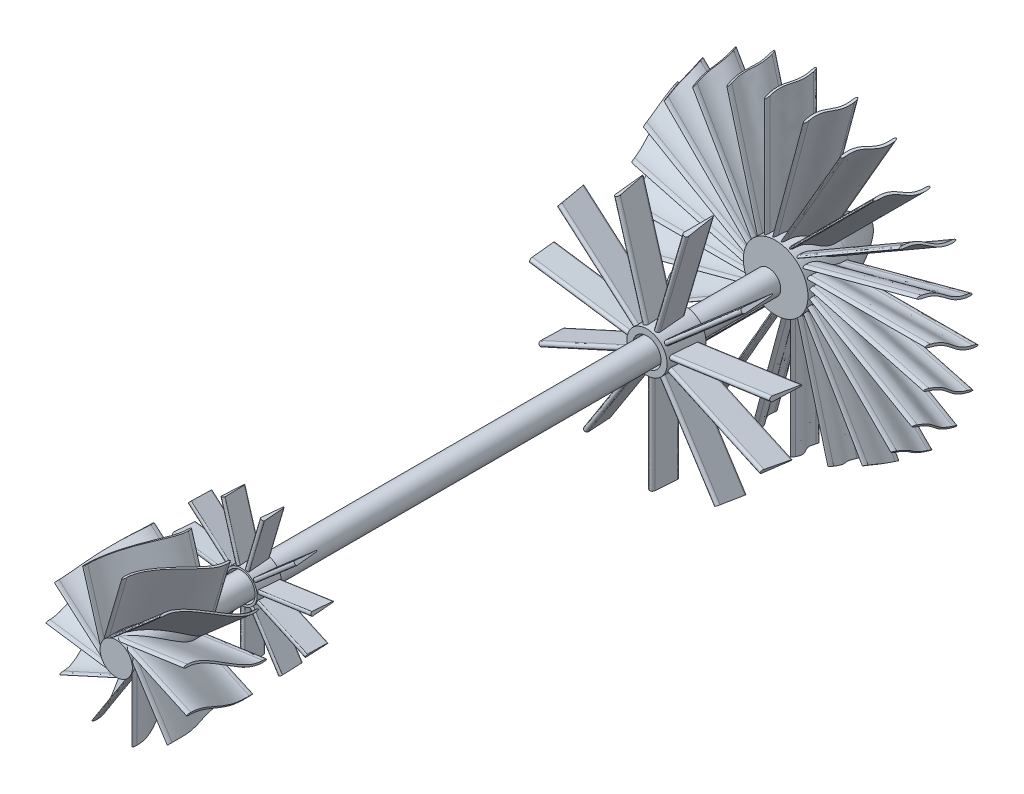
SolidWorks part; units mm, degrees
ref_plane "Front Plane" through (0, 0, 0) normal (0, 0, 1) x (1, 0, 0)
ref_plane "Top Plane" through (0, 0, 0) normal (0, 1, 0) x (1, 0, 0)
ref_plane "Right Plane" through (0, 0, 0) normal (1, 0, 0) x (0, 0, -1)
sketch "Sketch1" plane through (0, 0, 0) normal (0, 0, 1) x (1, 0, 0)
  circle A0 centre (0, 0) radius 50.8
  dimension "D1" = 101.6
extrude "Boss-Extrude1" add sketch "Sketch1" along normal blind 63.5
sketch "Sketch2" plane through (0, 0, 0) normal (1, 0, 0) x (0, 0, -1)
  line L0 (0, 0) -> (83.5751, 0) construction
  line L1 (83.5751, 12.1171) -> (83.5751, -12.1171) construction
  line L2 (12.7755, -50.8) -> (-12.7755, -50.8) construction
  line L3 (0, 0) -> (83.5751, 0)
  line L4 (0, -50.8) -> (0, 0)
  spline S0 degree 3 poles (0, -50.8) (21.0124, -50.8) (83.5751, -14.6698) (83.5751, 0) knots 0 0 0 0 1 1 1 1
revolve "Revolve1" add sketch "Sketch2" angle 360 about L3
shell "Shell1" thickness 2.54
ref_plane "Plane1" through (0, -254, 0) normal (0, 1, 0) x (1, 0, 0)
sketch "Sketch3" plane through (0, -254, 0) normal (0, 1, 0) x (1, 0, 0)
  line L0 (18.1199, -56.642) -> (21.9299, -56.642) construction
  line L1 (21.9299, -56.642) -> (3.81, -6.858) construction
  line L2 (3.81, -6.858) -> (0, -6.858) construction
  line L3 (0, -6.858) -> (18.1199, -56.642) construction
  line L4 (18.1199, -62.6708) -> (18.1199, -61.7892) construction
  line L5 (-48.26, -63.5) -> (48.26, -63.5) construction
  line L6 (3.81, -7.9931) -> (3.81, -4.674) construction
  line L7 (21.9299, -63.5) -> (21.9299, -56.642) construction
  line L8 (21.9299, -61.9314) -> (21.9299, -64.2229) construction
  line L9 (0, 0) -> (0, -6.858) construction
  line L10 (50.8, 0) -> (-50.8, 0) construction
  line L11 (18.1199, -86.5521) -> (18.1199, -36.0893) construction
  line L12 (0, -16.7791) -> (0, 18.5941) construction
  line L13 (21.9299, -38.0479) -> (21.9299, -88.039) construction
  line L14 (3.81, 14.5783) -> (3.81, -21.5913) construction
  line L15 (-50.8, -63.5) -> (50.8, -63.5) construction
  line L16 (0, -5.0138) -> (0, -7.7366) construction
  line L17 (0, 0) -> (0, -6.858) construction
  spline S0 degree 3 poles (0, -6.858) (0, 1.6087) (3.81, 1.6087) (3.81, -6.858) knots 0 0 0 0 1 1 1 1
  spline S1 degree 3 poles (18.1199, -56.642) (18.1199, -65.1087) (21.9299, -65.1087) (21.9299, -56.642) knots 0 0 0 0 1 1 1 1
  spline S2 degree 3 poles (0, -6.858) (0, -32.258) (18.1199, -31.242) (18.1199, -56.642) knots 0 0 0 0 1 1 1 1
  spline S3 degree 3 poles (21.9299, -56.642) (21.9299, -31.242) (3.81, -32.258) (3.81, -6.858) knots 0 0 0 0 1 1 1 1
  dimension "D3" = 6.858
  dimension "D1" = 3.81
  dimension "D2" = 6.858
  dimension "D4" = 250
  dimension "D5" = 3.81
extrude "Boss-Extrude2" add sketch "Sketch3" along normal offset from surface (205.486 mm away) 2.286 separate body contours S3 S0 S2 S1
pattern_circular "CirPattern1" count 24 over 360 about axis through (0, 0, 63.5) along (0, 0, -1)
sketch "Sketch6" plane through (0, 0, 0) normal (0, 1, 0) x (1, 0, 0)
  line L0 (0, -99.6848) -> (0, 145.6048) construction
sketch "Sketch7" plane through (0, 0, 63.5) normal (0, 0, 1) x (1, 0, 0)
  circle A0 centre (0, 0) radius 50.8
extrude "Boss-Extrude3" add sketch "Sketch7" along normal blind 2.54
sketch "Sketch8" plane through (0, 0, 66.04) normal (0, 0, 1) x (1, 0, 0)
  circle A0 centre (0, 0) radius 19.05
  dimension "D1" = 38.1
extrude "Boss-Extrude4" add sketch "Sketch8" along normal blind 1016 separate body
sketch "Sketch9" plane through (0, 0, 1082.04) normal (0, 0, 1) x (1, 0, 0)
  circle A0 centre (0, 0) radius 25.4
  dimension "D1" = 50.8
extrude "Boss-Extrude5" add sketch "Sketch9" against normal blind 127 separate body contours A0
ref_plane "Plane2" through (0, -114.3, 0) normal (0, 1, 0) x (1, 0, 0)
sketch "Sketch11" plane through (0, -114.3, 0) normal (0, 1, 0) x (1, 0, 0)
  line L0 (25.4, -955.04) -> (-25.4, -955.04) construction
  line L1 (-25.4, -1082.04) -> (25.4, -1082.04) construction
  line L3 (-25.4, -962.66) -> (-22.352, -962.66) construction
  line L4 (-25.4, -955.04) -> (-25.4, -1082.04) construction
  line L5 (22.352, -1074.42) -> (25.4, -1074.42) construction
  line L6 (-25.4, -962.66) -> (22.352, -1074.42) construction
  line L7 (25.4, -1074.42) -> (-22.352, -962.66) construction
  line L8 (25.4, -1082.04) -> (25.4, -1074.42) construction
  line L9 (-25.4, -920.8575) -> (-25.4, -1004.4715) construction
  line L10 (-22.352, -1008.3331) -> (-22.352, -916.9869) construction
  line L11 (25.4, -1104.5669) -> (25.4, -1044.2731) construction
  line L12 (22.352, -1041.7223) -> (22.352, -1107.1177) construction
  line L13 (25.4, -1073.3056) -> (25.4, -1075.858) construction
  line L14 (22.352, -1075.1042) -> (22.352, -1073.4873) construction
  line L15 (-22.352, -963.4217) -> (-22.352, -960.9194) construction
  line L16 (-25.4, -962.0208) -> (-25.4, -963.795) construction
  spline S0 degree 3 poles (22.352, -1074.42) (22.352, -1040.5533) (-25.4, -996.5267) (-25.4, -962.66) knots 0 0 0 0 1 1 1 1
  spline S1 degree 3 poles (-22.352, -962.66) (-22.352, -996.5267) (25.4, -1040.5533) (25.4, -1074.42) knots 0 0 0 0 1 1 1 1
  spline S2 degree 3 poles (22.352, -1074.42) (22.352, -1082.8867) (25.4, -1082.8867) (25.4, -1074.42) knots 0 0 0 0 1 1 1 1
  spline S3 degree 3 poles (-25.4, -962.66) (-25.4, -954.1933) (-22.352, -954.1933) (-22.352, -962.66) knots 0 0 0 0 1 1 1 1
  dimension "D1" = 3.048
  dimension "D2" = 7.62
  dimension "D3" = 3.048
  dimension "D4" = 7.62
  dimension "D5" = 246.864
extrude "Boss-Extrude6" add sketch "Sketch11" along normal offset from surface (104.7757 mm away) 2.54 separate body contours S1 S2 S0 S3
sketch "Sketch12" plane through (0, 0, 0) normal (0, 1, 0) x (1, 0, 0)
  line L0 (0, -1104.7568) -> (0, -908.6135) construction
pattern_circular "CirPattern2" count 11 over 360 about axis through (0, 0, 955.04) along (0, 0, 1)
ref_plane "Plane3" through (0, 0, 203.2) normal (0, 0, 1) x (1, 0, 0)
sketch "Sketch13" plane through (0, 0, 203.2) normal (0, 0, 1) x (1, 0, 0)
  circle A0 centre (0, 0) radius 22.225
  circle A1 centre (0, 0) radius 31.75
  dimension "D1" = 44.45
  dimension "D2" = 63.5
extrude "Boss-Extrude7" add sketch "Sketch13" along normal blind 60.96 separate body
sketch "Sketch14" plane through (0, -254, 0) normal (0, 1, 0) x (1, 0, 0)
  line L0 (0, -201.5053) -> (0, -264.16) construction
  line L1 (-31.75, -264.16) -> (31.75, -264.16) construction
  line L2 (0, -204.0453) -> (-3.582, -255.27) construction
  line L3 (-3.582, -255.27) -> (3.582, -255.27) construction
  line L4 (3.582, -255.27) -> (0, -204.0453) construction
  line L5 (-0.8881, -216.7453) -> (0.8881, -216.7453) construction
  line L6 (3.3363, -251.7566) -> (3.8277, -258.7836) construction
  line L7 (-3.7322, -257.4175) -> (-3.4145, -252.8752) construction
  line L8 (0.9313, -217.363) -> (0.8275, -215.8786) construction
  line L9 (-0.8624, -216.3783) -> (-0.9285, -217.3238) construction
  line L10 (-3.582, -255.27) -> (-0.8881, -216.7453)
  line L11 (0.8881, -216.7453) -> (3.582, -255.27)
  spline S0 degree 3 poles (-3.582, -255.27) (-3.9954, -261.1822) (3.9954, -261.1822) (3.582, -255.27) knots 0 0 0 0 1 1 1 1
  spline S1 degree 3 poles (-0.8881, -216.7453) (-0.7109, -214.2115) (0.7109, -214.2115) (0.8881, -216.7453) knots 0 0 0 0 1 1 1 1
  dimension "D1" = 2.54
  dimension "D2" = 4
  dimension "D3" = 4
  dimension "D4" = 8.89
  dimension "D5" = 15.24
extrude "Boss-Extrude8" add sketch "Sketch14" along normal offset from surface (225.0105 mm away) 2.54 separate body contours L11 S0 L10 S1
pattern_circular "CirPattern3" count 11 over 360 about axis through (0, 0, 264.16) along (0, 0, -1)
ref_plane "Plane4" through (0, 0, 889) normal (0, 0, 1) x (1, 0, 0)
sketch "Sketch15" plane through (0, 0, 889) normal (0, 0, 1) x (1, 0, 0)
  circle A0 centre (0, 0) radius 22.225
  circle A1 centre (0, 0) radius 25.4651
extrude "Boss-Extrude9" add sketch "Sketch15" against normal blind 38.1 separate body
sketch "Sketch16" plane through (0, -114.3, 0) normal (0, 1, 0) x (1, 0, 0)
  line L0 (0, -843.3091) -> (0, -892.7814) construction
  line L1 (0, -843.3091) -> (-2.9735, -885.832) construction
  line L2 (-2.9735, -885.832) -> (2.9735, -885.832) construction
  line L3 (2.9735, -885.832) -> (0, -843.3091) construction
  line L4 (-0.7082, -853.4367) -> (0.7082, -853.4367) construction
  line L5 (2.9227, -885.1063) -> (3.1462, -888.3021) construction
  line L6 (-3.0061, -886.2986) -> (-2.8266, -883.7319) construction
  line L7 (-1.1663, -859.9878) -> (-1.2626, -861.3647) construction
  line L8 (1.2601, -861.3287) -> (1.1213, -859.3444) construction
  line L9 (-2.9735, -885.832) -> (-0.7082, -853.4367)
  line L10 (0.7082, -853.4367) -> (2.9735, -885.832)
  spline S0 degree 3 poles (-2.9735, -885.832) (-3.1507, -888.3658) (3.1507, -888.3658) (2.9735, -885.832) knots 0 0 0 0 1 1 1 1
  spline S1 degree 3 poles (-0.7082, -853.4367) (-0.5901, -851.7475) (0.5901, -851.7475) (0.7082, -853.4367) knots 0 0 0 0 1 1 1 1
  dimension "D3" = 5.947
  dimension "D4" = 1.4164
  dimension "D1" = 176
  dimension "D2" = 176
extrude "Boss-Extrude10" add sketch "Sketch16" along normal offset from surface (90.2883 mm away) 1.27 separate body contours L10 S0 L9 S1
pattern_circular "CirPattern4" count 11 over 360 about axis through (0, 0, 850.9) along (0, 0, 1)
sketch "Sketch17" plane through (0, 0, 0) normal (0, 1, 0) x (1, 0, 0)
  line L0 (-259.4955, -43.5301) -> (-259.4955, 70.1436) construction
  line L1 (-110.6437, -1316.1124) -> (-110.6437, -853.5386) construction
  line L2 (-259.4955, 45.4622) -> (-387.328, 45.4622)
  line L3 (-387.328, 45.4622) -> (-387.328, -1084.8928)
  line L4 (-387.328, -1084.8928) -> (-110.6437, -1084.8928)
  spline S0 degree 3 poles (-259.4955, 45.4622) (-259.4955, -7.1736) (-207.7477, -105.8122) (-173.3147, -383.1384) (-92.4228, -818.9689) (-110.6437, -795.7842) (-110.6437, -1084.8928) knots 0 0 0 0 0.158009 0.206507 0.484977 1 1 1 1
revolve "Cut-Revolve2" cut sketch "Sketch17" angle 360 about L0
ref_plane "Plane5" through (289.9098, 0, 0) normal (1, 0, 0) x (0, 0, -1)
scale "Scale1" bodies to scale 216 215 214 213 223 222 221 217 218 219 220 165 212 202 203 204 205 211 206 207 208 209 210 189 190 197 198 199 200 201 191 152 196 195 192 193 194 153 177 scale about centroid uniform scaling yes scale factor 0.98
